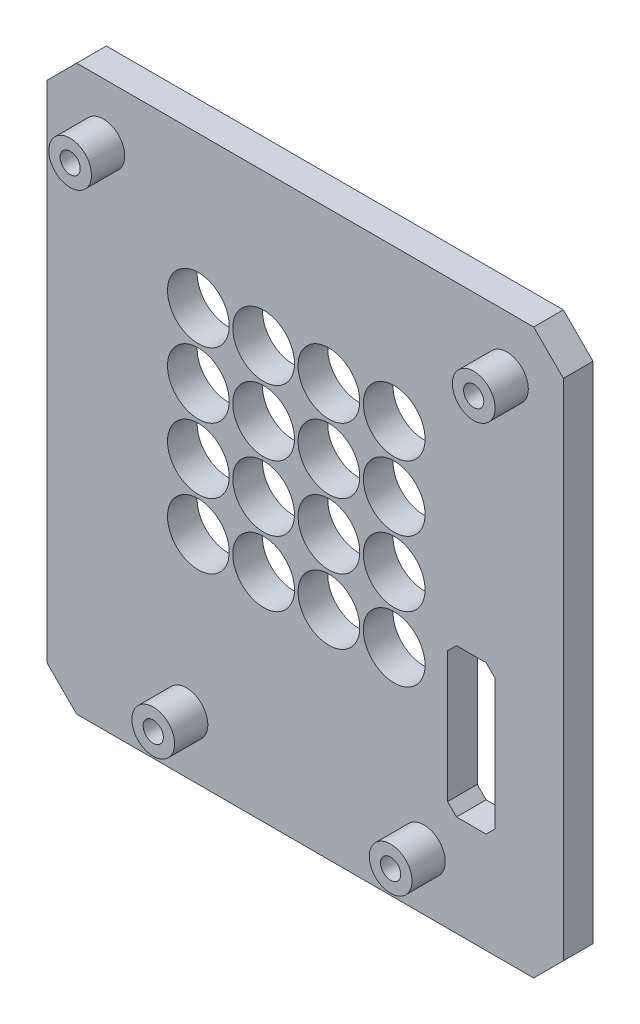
SolidWorks part; units mm, degrees
ref_plane "前视基准面" through (0, 0, 0) normal (0, 0, 1) x (1, 0, 0)
ref_plane "上视基准面" through (0, 0, 0) normal (0, 1, 0) x (1, 0, 0)
ref_plane "右视基准面" through (0, 0, 0) normal (1, 0, 0) x (0, 0, -1)
other "Configuration Table"
sketch "草图1" plane through (0, 0, 0) normal (0, 0, 1) x (1, 0, 0)
  line L0 (-37, -53) -> (40, -53)
  line L1 (40, -53) -> (45, -48)
  line L2 (45, -48) -> (45, 37)
  line L3 (45, 37) -> (40, 42)
  line L4 (40, 42) -> (-37, 42)
  line L5 (-37, 42) -> (-42, 37)
  line L6 (-42, 37) -> (-42, -48)
  line L7 (-42, -48) -> (-37, -53)
  line L8 (27, -36) -> (32, -36)
  line L9 (32, -36) -> (33.5, -34.5)
  line L10 (33.5, -34.5) -> (33.5, -12.5)
  line L11 (33.5, -12.5) -> (32, -11)
  line L12 (32, -11) -> (27, -11)
  line L13 (27, -11) -> (25.5, -12.5)
  line L14 (25.5, -12.5) -> (25.5, -34.5)
  line L15 (25.5, -34.5) -> (27, -36)
  circle A0 centre (-16.5, -16.5) radius 5.2
  circle A1 centre (-5.5, -16.5) radius 5.2
  circle A2 centre (5.5, -16.5) radius 5.2
  circle A3 centre (16.5, -16.5) radius 5.2
  circle A4 centre (-16.5, -5.5) radius 5.2
  circle A5 centre (-5.5, -5.5) radius 5.2
  circle A6 centre (5.5, -5.5) radius 5.2
  circle A7 centre (16.5, -5.5) radius 5.2
  circle A8 centre (-16.5, 5.5) radius 5.2
  circle A9 centre (-5.5, 5.5) radius 5.2
  circle A10 centre (5.5, 5.5) radius 5.2
  circle A11 centre (16.5, 5.5) radius 5.2
  circle A12 centre (-16.5, 16.5) radius 5.2
  circle A13 centre (-5.5, 16.5) radius 5.2
  circle A14 centre (5.5, 16.5) radius 5.2
  circle A15 centre (16.5, 16.5) radius 5.2
  circle A16 centre (-32.5, 32.5) radius 1.7
  circle A17 centre (35.5, 32.5) radius 1.7
  circle A18 centre (-18.5, -43.5) radius 1.7
  circle A19 centre (21.5, -43.5) radius 1.7
  dimension "D1" = 3.4
  dimension "D2" = 10.4
  dimension "D3" = 5.5
  dimension "D4" = 16.5
  dimension "D5" = 21.5
  dimension "D6" = 25.5
  dimension "D7" = 27
  dimension "D8" = 32
  dimension "D9" = 35.5
  dimension "D10" = 40
  dimension "D11" = 45
  dimension "D12" = 5.5
  dimension "D13" = 16.5
  dimension "D14" = 37
  dimension "D15" = 18.5
  dimension "D16" = 32.5
  dimension "D17" = 5.5
  dimension "D18" = 16.5
  dimension "D19" = 32.5
  dimension "D20" = 37
  dimension "D21" = 42
  dimension "D22" = 5.5
  dimension "D23" = 11
  dimension "D24" = 12.5
  dimension "D25" = 16.5
  dimension "D26" = 34.5
  dimension "D27" = 43.5
  dimension "D28" = 48
extrude "Guide_16_THROUGH_bores_and_R2_R16_window" add sketch "草图1" along normal blind 5
sketch "草图2" plane through (0, 0, 0) normal (0, 0, 1) x (1, 0, 0)
  circle A0 centre (-32.5, 32.5) radius 3.6
  circle A1 centre (-32.5, 32.5) radius 1.7
  circle A2 centre (35.5, 32.5) radius 3.6
  circle A3 centre (35.5, 32.5) radius 1.7
  circle A4 centre (-18.5, -43.5) radius 3.6
  circle A5 centre (-18.5, -43.5) radius 1.7
  circle A6 centre (21.5, -43.5) radius 3.6
  circle A7 centre (21.5, -43.5) radius 1.7
  dimension "D1" = 3.4
  dimension "D2" = 7.2
  dimension "D3" = 21.5
  dimension "D4" = 35.5
  dimension "D5" = 18.5
  dimension "D6" = 32.5
  dimension "D7" = 32.5
  dimension "D8" = 43.5
extrude "PCB_front_datum_10p6" add sketch "草图2" along normal blind 5.6 from offset 5
